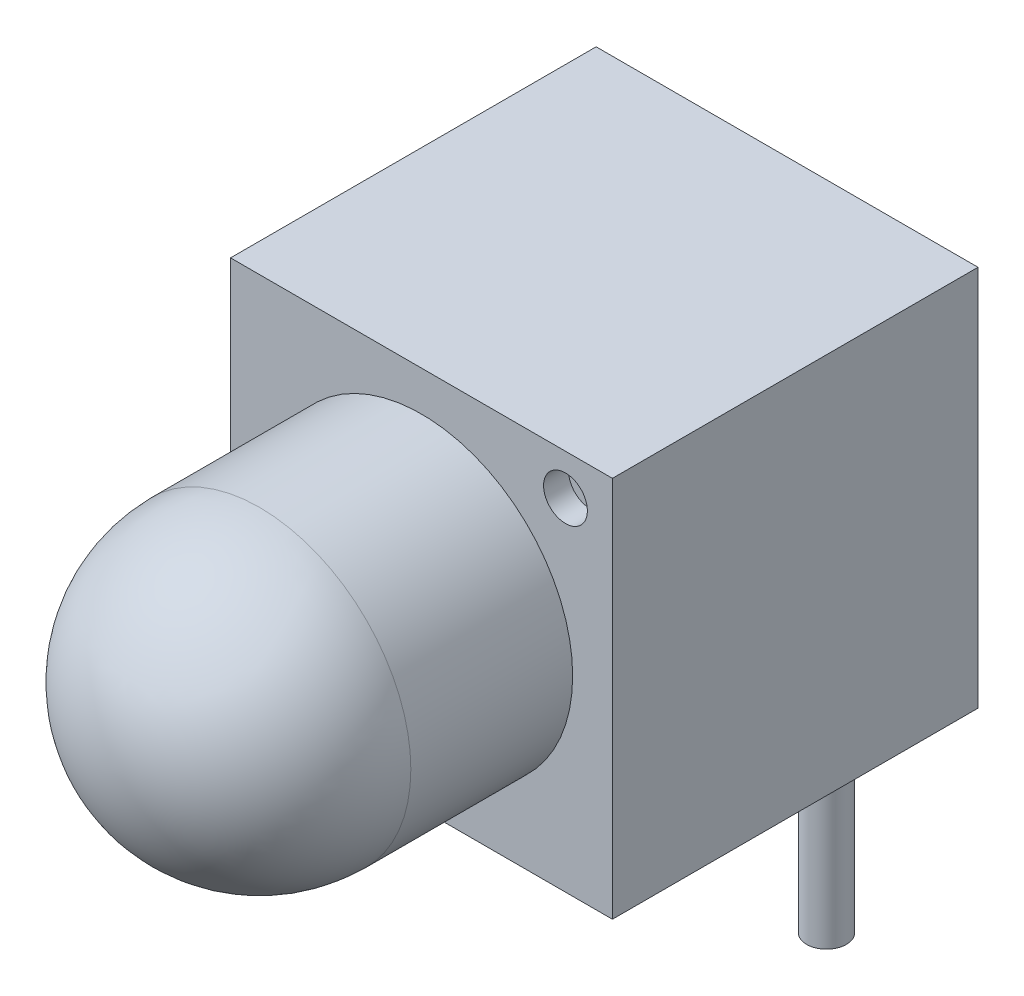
SolidWorks part; units mm, degrees
ref_plane "Front" through (0, 0, 0) normal (0, 0, 1) x (1, 0, 0)
ref_plane "Top" through (0, 0, 0) normal (0, 1, 0) x (1, 0, 0)
ref_plane "Right" through (0, 0, 0) normal (1, 0, 0) x (0, 0, -1)
sketch "Эскиз1" plane through (0, 0, 0) normal (0, 1, 0) x (1, 0, 0)
  line L1 (-3.05, 0) -> (3.05, 0)
  line L2 (-3.05, 0) -> (-3.05, 5.84)
  line L3 (-3.05, 5.84) -> (3.05, 5.84)
  line L4 (3.05, 0) -> (3.05, 5.84)
  dimension "D1" = 6.1
  dimension "D2" = 5.84
extrude "Вытянуть1" add sketch "Эскиз1" along normal blind 6.1
sketch "Эскиз2" plane through (0, 0, 0) normal (1, 0, 0) x (0, 0, -1)
  line L0 (0, 5.465) -> (-2.585, 5.465)
  line L1 (0, 6.1) -> (0, 0) construction
  line L2 (-5, 3.05) -> (0, 3.05) construction
  line L3 (0, 3.05) -> (0, 5.465)
  line L4 (-5, 3.05) -> (0, 3.05)
  arc A0 (-2.585, 5.465) -> (-5, 3.05) centre (-2.585, 3.05) ccw
  dimension "A" = 5
  dimension "D2" = 4.83
revolve "Повернуть1" add sketch "Эскиз2" angle 360 about L2
sketch "Эскиз3" plane through (0, 0, 0) normal (0, -1, 0) x (1, 0, 0)
  line L0 (0, 0) -> (0, -5.84) construction
  line L1 (-3.05, 0) -> (3.05, 0) construction
  line L2 (3.05, -5.84) -> (-3.05, -5.84) construction
  circle A0 centre (-1.27, -5.2) radius 0.3175
  circle A1 centre (1.27, -5.2) radius 0.3175
  dimension "B" = 0.635
  dimension "D2" = 2.54
  dimension "D3" = 5.2
extrude "Вытянуть2" add sketch "Эскиз3" along normal blind 3.68
sketch "Эскиз4" plane through (0, 0, 0) normal (0, 0, 1) x (1, 0, 0)
  circle A0 centre (2.3, 5.45) radius 0.35
  circle A1 centre (0, 3.05) radius 2.415 construction
  dimension "D1" = 0.7
  dimension "D2" = 2.3
  dimension "D3" = 2.4
extrude "Вытянуть3" cut sketch "Эскиз4" against normal blind 0.4
